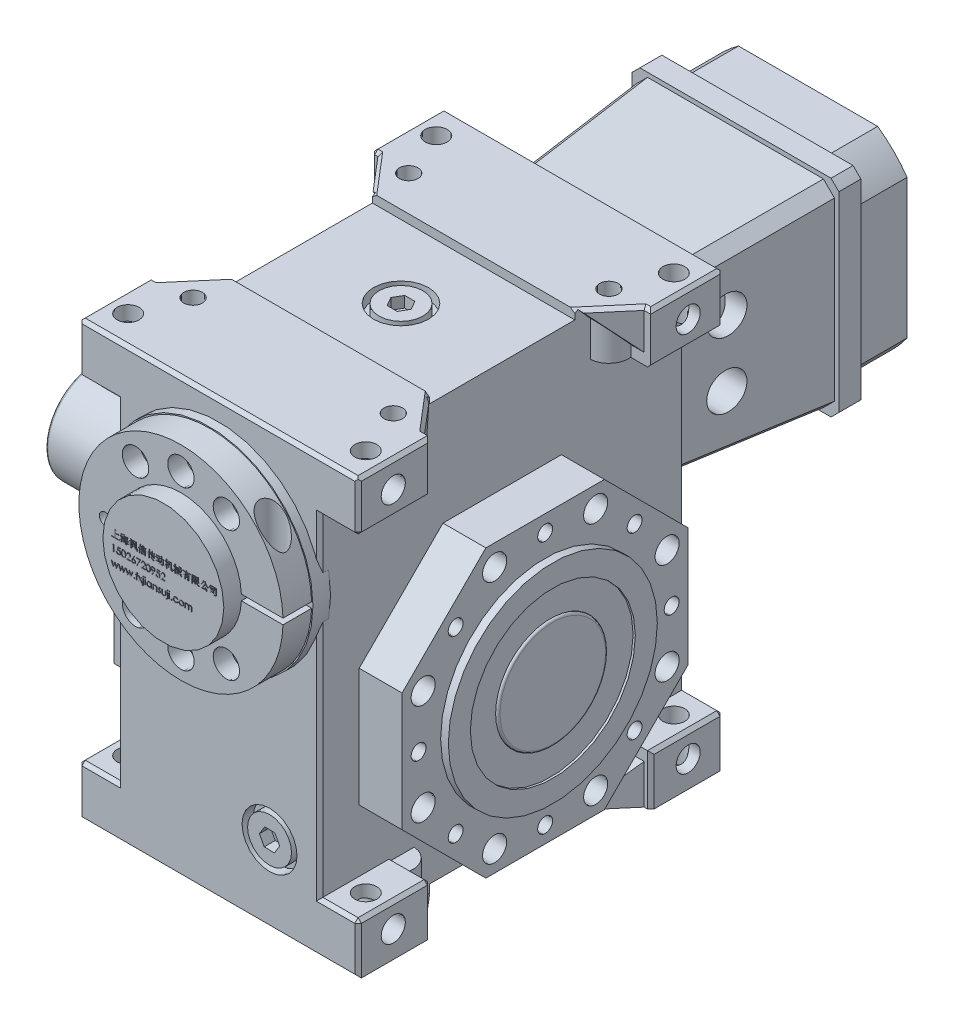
SolidWorks part; units mm, degrees
ref_plane "前视基准面" through (0, 0, 0) normal (0, 0, 1) x (1, 0, 0)
ref_plane "上视基准面" through (0, 0, 0) normal (0, 1, 0) x (1, 0, 0)
ref_plane "右视基准面" through (0, 0, 0) normal (1, 0, 0) x (0, 0, -1)
imported_body "JDLB063-CR箱体-1-solid1"
imported_body "JDLB063-CR箱体-1-solid2"
imported_body "JDLB063-ASR实心轴Φ45-1-solid1"
imported_body "JDLB063-ST94输入法兰-1-solid1"
imported_body "ST90-70-90-M6伺服法兰接口-1-solid1"
imported_body "联轴器BD56-60-20-19锁紧-1-solid1"
imported_body "联轴器BD56-60-20-19锁紧-1-solid2"
imported_body "联轴器BD56-60-20-19锁紧-1-solid3"
imported_body "联轴器BD56-60-20-19锁紧-1-solid4"
imported_body "联轴器BD56-60-20-19锁紧-1-solid5"
imported_body "联轴器BD56-60-20-19锁紧-1-solid6"
imported_body "联轴器BD56-60-20-19锁紧-1-solid7"
imported_body "联轴器BD56-60-20-19锁紧-1-solid8"
imported_body "联轴器BD56-60-20-19锁紧-1-solid9"
imported_body "联轴器BD56-60-20-19锁紧-1-solid10"
imported_body "联轴器BD56-60-20-19锁紧-1-solid11"
sketch "草图2" plane through (46, 0, 0) normal (1, 0, 0) x (0, 0, -1)
  line L1 (-33.0787, 102.359) -> (35.8643, 102.359)
  line L2 (-33.0787, 102.359) -> (-33.0787, 85.6265)
  line L3 (-33.0787, 85.6265) -> (35.8643, 85.6265)
  line L4 (35.8643, 102.359) -> (35.8643, 85.6265)
  point P4 (35.8643, 85.6265)
extrude "切除-拉伸2" cut sketch "草图2" along normal up to surface (1 mm away)
sketch "草图3" plane through (-46, 0, 0) normal (-1, 0, 0) x (0, 0, 1)
  line L1 (-28.4304, 101.0072) -> (24.6607, 101.0072)
  line L2 (-28.4304, 101.0072) -> (-28.4304, 84.5263)
  line L3 (-28.4304, 84.5263) -> (24.6607, 84.5263)
  line L4 (24.6607, 101.0072) -> (24.6607, 84.5263)
extrude "切除-拉伸3" cut sketch "草图3" along normal up to surface (1 mm away)
sketch "草图4" plane through (0, 0, 108) normal (0, 0, 1) x (1, 0, 0)
  text T0 "上海枫信传动机械有限公司  15026720952  www.fxjiansuji.com" font "Century Gothic" height in points 11
extrude "凸台-拉伸1" add sketch "草图4" along normal blind 0.2
